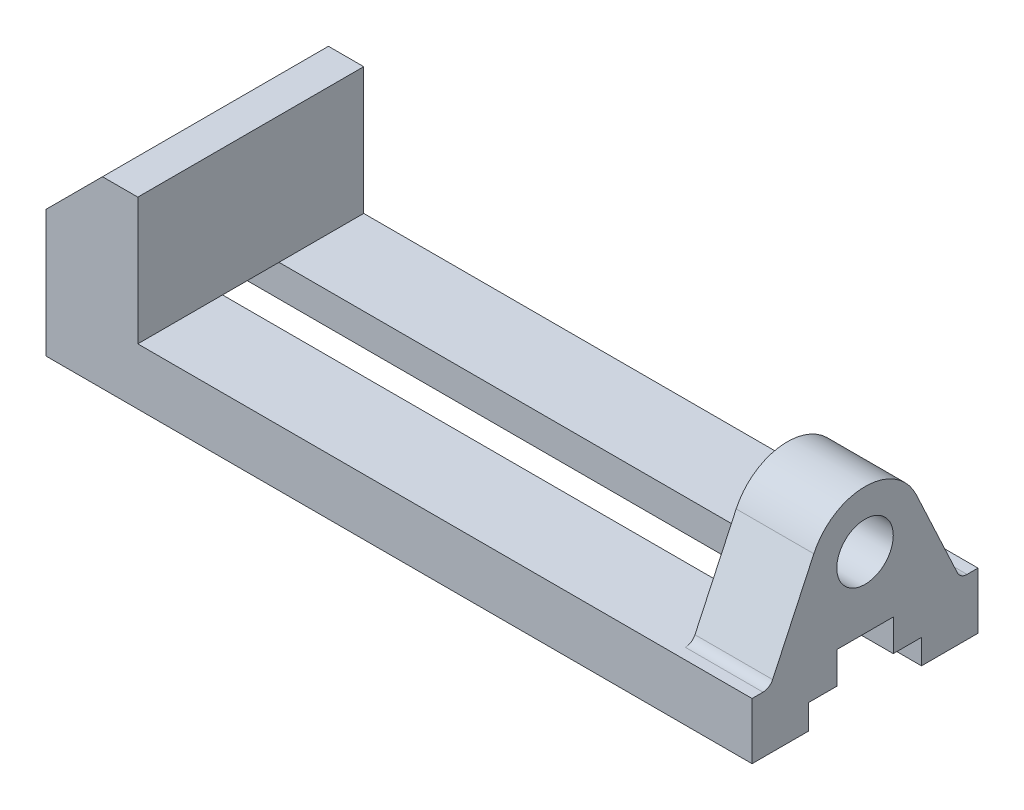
SolidWorks part; units mm, degrees
ref_plane "Front" through (0, 0, 0) normal (0, 0, 1) x (1, 0, 0)
ref_plane "Top" through (0, 0, 0) normal (0, 1, 0) x (1, 0, 0)
ref_plane "Right" through (0, 0, 0) normal (1, 0, 0) x (0, 0, -1)
sketch "Sketch1" plane through (0, 0, 0) normal (0, 0, 1) x (1, 0, 0)
  line L0 (0, 0) -> (200, 0)
  line L1 (200, 0) -> (200, 16)
  line L2 (200, 16) -> (26, 16)
  line L3 (26, 16) -> (26, 52)
  line L4 (26, 52) -> (16, 52)
  line L5 (16, 52) -> (0, 36)
  line L6 (0, 36) -> (0, 0)
  dimension "D1" = 200
  dimension "D2" = 16
  dimension "D3" = 10
  dimension "D4" = 16
  dimension "D5" = 16
  dimension "D6" = 36
extrude "Extrude1" add sketch "Sketch1" along normal mid plane 64
sketch "Sketch2" plane through (200, 0, 0) normal (1, 0, 0) x (0, 0, -1)
  line L0 (14.5009, 42.7619) -> (26.9802, 16)
  line L1 (-32, 52) -> (32, 52) construction
  line L2 (-32, 16) -> (32, 16) construction
  line L3 (0, 52.7641) -> (0, -22.9682) construction
  line L5 (-14.5009, 42.7619) -> (-26.9802, 16)
  line L7 (-26.9802, 16) -> (26.9802, 16)
  arc A1 (14.5009, 42.7619) -> (-14.5009, 42.7619) centre (0, 36) ccw
  dimension "D1" = 16
  dimension "D2" = 50
extrude "Extrude3" add sketch "Sketch2" against normal blind 22
fillet "Fillet1" radius 3 2 edges at (189, 16, -26.9802) (189, 16, 26.9802)
other "Hole1"
sketch "Sketch3" plane through (200, 0, 0) normal (1, 0, 0) x (0, 0, -1)
  circle A0 centre (0, 36) radius 8
  arc A1 (14.5009, 42.7619) -> (-14.5009, 42.7619) centre (0, 36) ccw construction
  dimension "D1" = 16
sketch "Sketch4" plane through (200, 0, 0) normal (1, 0, 0) x (0, 0, -1)
  line L0 (0, 0) -> (0, 54.7774) construction
  line L1 (-16, 0) -> (-16, 7)
  line L2 (-32, 0) -> (32, 0) construction
  line L3 (16, 0) -> (16, 7)
  line L4 (-16, 7) -> (-8, 7)
  line L5 (16, 7) -> (8, 7)
  line L6 (-8, 7) -> (-8, 16)
  line L7 (8, 7) -> (8, 16)
  line L8 (-8, 16) -> (8, 16)
  line L9 (-16, 0) -> (16, 0)
  point P14 (0, 16)
  dimension "D1" = 16
  dimension "D2" = 32
  dimension "D3" = 16
  dimension "D4" = 7
extrude "Cut-Extrude1" cut sketch "Sketch4" against normal through all
ref_plane "Plane1" through (0, 0, 22) normal (0, 0, 1) x (1, 0, 0)
sketch "Sketch6" plane through (0, 0, 22) normal (0, 0, 1) x (1, 0, 0)
  line L0 (162, 26.4839) -> (162, -16.0264) construction
  line L1 (200, 0) -> (200, 16) construction
  line L2 (162, 11.7321) -> (165, 10)
  line L3 (165, 10) -> (165, 0)
  line L4 (0, 0) -> (200, 0) construction
  line L5 (165, 0) -> (162, 0)
  line L6 (162, 0) -> (162, 11.7321)
  dimension "D1" = 38
  dimension "D2" = 6
  dimension "D3" = 10
  dimension "D4" = 60
revolve "Cut-Revolve1" cut sketch "Sketch6" angle 360 about L0
pattern_linear "LPattern2" count 2 spacing 70 along (-1, 0, 0) count 2 spacing 44 along (0, 0, -1) of "Cut-Revolve1"
sketch "Sketch7" plane through (0, 16, 0) normal (0, 1, 0) x (-1, 0, 0)
  ellipse E0 centre (-74.8282, 19.0243) end of major axis (-49.5999, 18.4376) minor radius 4.8493
